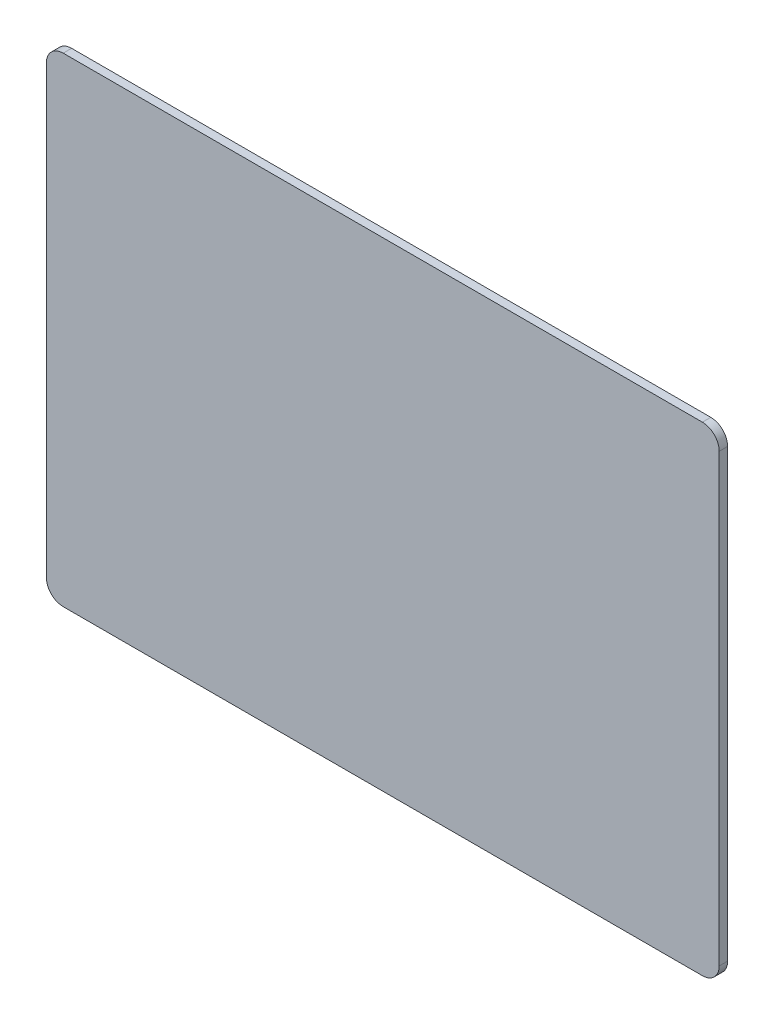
SolidWorks part; units mm, degrees
ref_plane "Plan de face" through (0, 0, 0) normal (0, 0, 1) x (1, 0, 0)
ref_plane "Plan de dessus" through (0, 0, 0) normal (0, 1, 0) x (1, 0, 0)
ref_plane "Plan de droite" through (0, 0, 0) normal (1, 0, 0) x (0, 0, -1)
sketch "Esquisse1" plane through (0, 0, 0) normal (0, 0, 1) x (1, 0, 0)
  line L5 (-3, -3) -> (77, -3)
  line L6 (-3, -3) -> (-3, 54)
  line L7 (-3, 54) -> (77, 54)
  line L8 (77, -3) -> (77, 54)
  dimension "D1" = 3
  dimension "D2" = 3
  dimension "D3" = 80
  dimension "D4" = 57
extrude "Boss.-Extru.1" add sketch "Esquisse1" along normal blind 2
fillet "Congé1" radius 2 4 edges at (-3, -3, 1) (77, -3, 1) (77, 54, 1) (-3, 54, 1)
sketch "Esquisse2" plane through (0, 0, 0) normal (0, 0, 1) x (1, 0, 0)
  line L1 (0, 0) -> (74, 0)
  line L2 (0, 0) -> (0, 51)
  line L3 (0, 51) -> (74, 51)
  line L4 (74, 0) -> (74, 51)
  dimension "D1" = 74
  dimension "D2" = 51
extrude "Enlèv. mat.-Extru.1" cut sketch "Esquisse2" along normal blind 1 draft 1 flip side to cut
